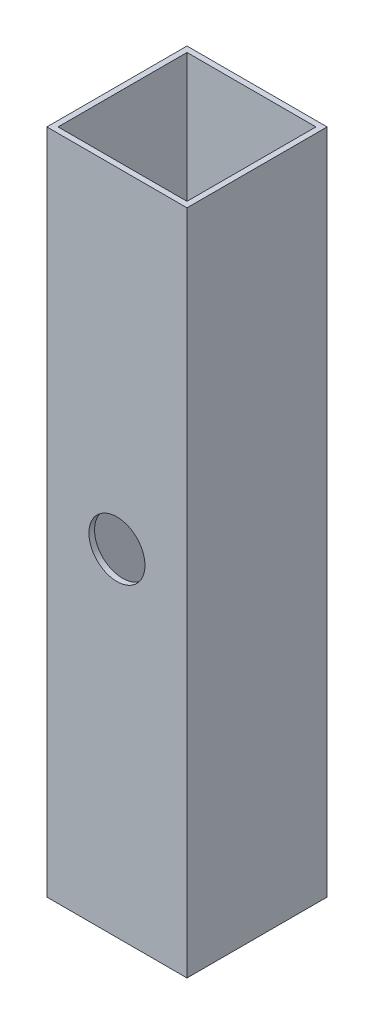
SolidWorks part; units mm, degrees
ref_plane "Front Plane" through (0, 0, 0) normal (0, 0, 1) x (1, 0, 0)
ref_plane "Top Plane" through (0, 0, 0) normal (0, 1, 0) x (1, 0, 0)
ref_plane "Right Plane" through (0, 0, 0) normal (1, 0, 0) x (0, 0, -1)
sketch "Sketch2" plane through (0, 0, 0) normal (0, 1, 0) x (1, 0, 0)
  line L1 (0, 0) -> (63.5, 0)
  line L2 (0, 0) -> (0, 63.5)
  line L3 (0, 63.5) -> (63.5, 63.5)
  line L4 (63.5, 0) -> (63.5, 63.5)
extrude "Boss-Extrude2" add sketch "Sketch2" against normal blind 304.8
sketch "Sketch3" plane through (0, 0, 0) normal (0, 1, 0) x (1, 0, 0)
  line L0 (0, 0) -> (0, 2.54)
  line L1 (0, 63.5) -> (0, 0) construction
  line L2 (0, 2.54) -> (2.54, 2.54)
  line L3 (63.5, 63.5) -> (63.5, 60.96)
  line L4 (63.5, 60.96) -> (60.96, 60.96)
  line L6 (2.54, 2.54) -> (60.96, 2.54)
  line L7 (2.54, 2.54) -> (2.54, 60.96)
  line L8 (2.54, 60.96) -> (60.96, 60.96)
  line L9 (60.96, 2.54) -> (60.96, 60.96)
extrude "Cut-Extrude2" cut sketch "Sketch3" against normal blind 302.26 contours L6 L9 L8 L7
sketch3d "3DSketch1"
  line L0 (0, 0, -63.5) -> (0, 0, 0) construction
  point P0 (0, 0, -61.7439)
sketch "Sketch5" plane through (0, 0, 0) normal (0, 1, 0) x (1, 0, 0)
  line L1 (0, 0) -> (63.5, 0)
  line L2 (0, 0) -> (0, 63.5)
  line L3 (0, 63.5) -> (63.5, 63.5)
  line L4 (63.5, 0) -> (63.5, 63.5)
extrude "Cut-Extrude3" cut sketch "Sketch5" against normal blind 2.54
sketch "Sketch6" plane through (0, 0, 0) normal (0, 0, 1) x (1, 0, 0)
  line L0 (0, -304.8) -> (63.5, -304.8)
  line L1 (63.5, -304.8) -> (31.75, -304.8)
  line L2 (31.75, -304.8) -> (31.75, -152.4)
  circle A0 centre (31.75, -152.4) radius 12.7
extrude "Cut-Extrude4" cut sketch "Sketch6" against normal blind 12.7
